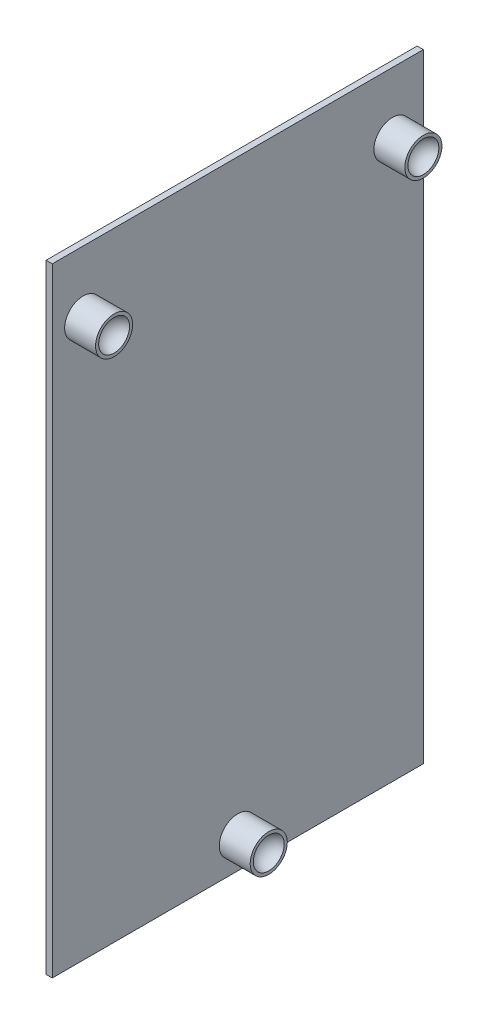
SolidWorks part; units mm, degrees
ref_plane "Front" through (0, 0, 0) normal (0, 0, 1) x (1, 0, 0)
ref_plane "Top" through (0, 0, 0) normal (0, 1, 0) x (1, 0, 0)
ref_plane "Right" through (0, 0, 0) normal (1, 0, 0) x (0, 0, -1)
sketch "Sketch1" plane through (0, 0, 0) normal (1, 0, 0) x (0, 0, -1)
  line L1 (-600, 2000) -> (600, 2000)
  line L2 (-600, 2000) -> (-600, 0)
  line L3 (-600, 0) -> (600, 0)
  line L4 (600, 2000) -> (600, 0)
  dimension "D1" = 1200
  dimension "D2" = 2000
extrude "Boss-Extrude1" add sketch "Sketch1" against normal blind 20
sketch "Sketch2" plane through (0, 0, 0) normal (0, 0, 1) x (1, 0, 0)
  line L0 (0, 100) -> (100, 100) construction
  line L1 (0, 2000) -> (0, 0) construction
  line L2 (0, 40) -> (100, 40)
  line L3 (50, 100) -> (0, 100)
  line L4 (0, 100) -> (0, 40)
  line L5 (100, 50) -> (100, 40)
  arc A0 (50, 100) -> (100, 50) centre (100, 100) ccw
  dimension "D1" = 50
  dimension "D2" = 120
  dimension "D3" = 100
  dimension "D4" = 100
revolve "Revolve1" add sketch "Sketch2" angle 360 about L0
ref_plane "Plane1" through (0, 0, 500) normal (0, 0, 1) x (1, 0, 0)
sketch "Sketch4" plane through (0, 0, 500) normal (0, 0, 1) x (1, 0, 0)
  line L0 (0, 1800) -> (100, 1800) construction
  line L2 (0, 1740) -> (100, 1740)
  line L3 (50, 1800) -> (0, 1800)
  line L4 (0, 1800) -> (0, 1740)
  line L5 (100, 1750) -> (100, 1740)
  line L6 (0, 2000) -> (0, 0) construction
  arc A0 (50, 1800) -> (100, 1750) centre (100, 1800) ccw
  dimension "D1" = 50
  dimension "D2" = 120
  dimension "D3" = 100
  dimension "D4" = 1800
revolve "Revolve2" add sketch "Sketch4" angle 360 about L0
mirror "Mirror1" about plane through (0, 0, 0) normal (0, 0, 1) of "Revolve2"
